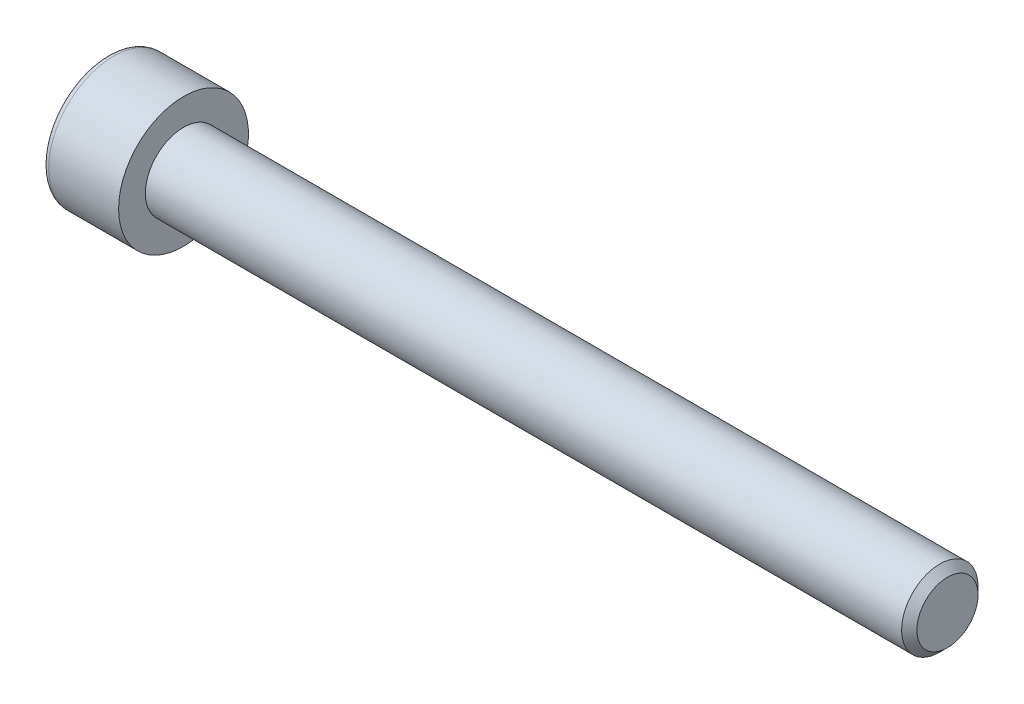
SolidWorks part; units mm, degrees
ref_plane "Front Plane" through (0, 0, 0) normal (0, 0, 1) x (1, 0, 0)
ref_plane "Top Plane" through (0, 0, 0) normal (0, 1, 0) x (1, 0, 0)
ref_plane "Right Plane" through (0, 0, 0) normal (1, 0, 0) x (0, 0, -1)
imported_body "07160-05x40"
sketch "Esquisse1" plane through (0, 0, 0) normal (1, 0, 0) x (0, 0, -1)
  circle A0 centre (0, 0) radius 2.5
  dimension "D1" = 5
extrude "Boss.-Extru.1" add sketch "Esquisse1" along normal blind 50
chamfer "Chanfrein1" distance 0.5 angle 45 1 edges at (50, 0, -2.5)
